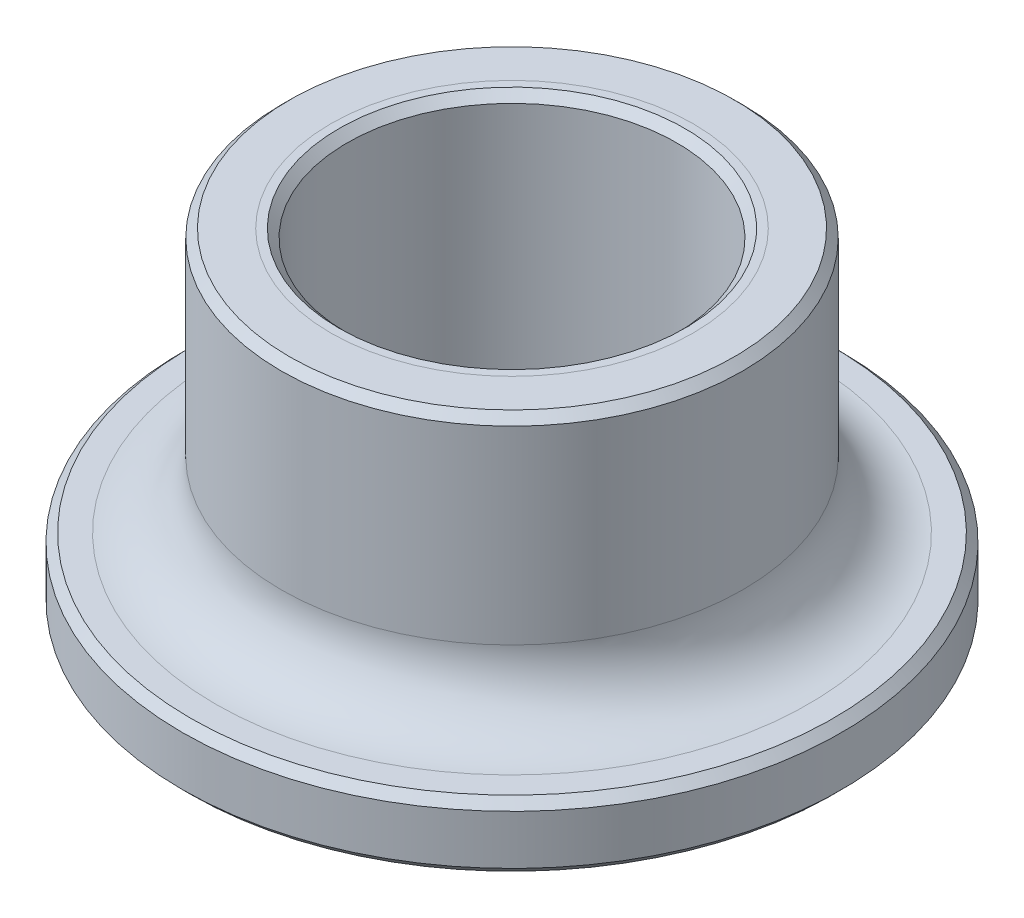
SolidWorks part; units mm, degrees
ref_plane "Front Plane" through (0, 0, 0) normal (0, 0, 1) x (1, 0, 0)
ref_plane "Top Plane" through (0, 0, 0) normal (0, 1, 0) x (1, 0, 0)
ref_plane "Right Plane" through (0, 0, 0) normal (1, 0, 0) x (0, 0, -1)
sketch "Sketch1" plane through (0, 0, 0) normal (0, 1, 0) x (1, 0, 0)
  circle A0 centre (0, 0) radius 10
  dimension "D1" = 20
extrude "Boss-Extrude1" add sketch "Sketch1" along normal blind 2
sketch "Sketch2" plane through (0, 2, 0) normal (0, 1, 0) x (1, 0, 0)
  circle A0 centre (0, 0) radius 7
  dimension "D1" = 14
extrude "Boss-Extrude2" add sketch "Sketch2" along normal blind 8
sketch "Sketch3" plane through (0, 10, 0) normal (0, 1, 0) x (1, 0, 0)
  circle A0 centre (0, 0) radius 5
  dimension "D1" = 10
extrude "Cut-Extrude1" cut sketch "Sketch3" against normal through all
sketch "Sketch4" plane through (0, 10, 0) normal (0, 1, 0) x (1, 0, 0)
  circle A2 centre (0, 0) radius 5.5
  circle A3 centre (0, 0) radius 5.5
  dimension "D1" = 0.5
chamfer "Chamfer1" distance 0.25 angle 45 1 edges at (0, 10, 5)
fillet "Fillet1" radius 2 1 edges at (0, 2, 7)
